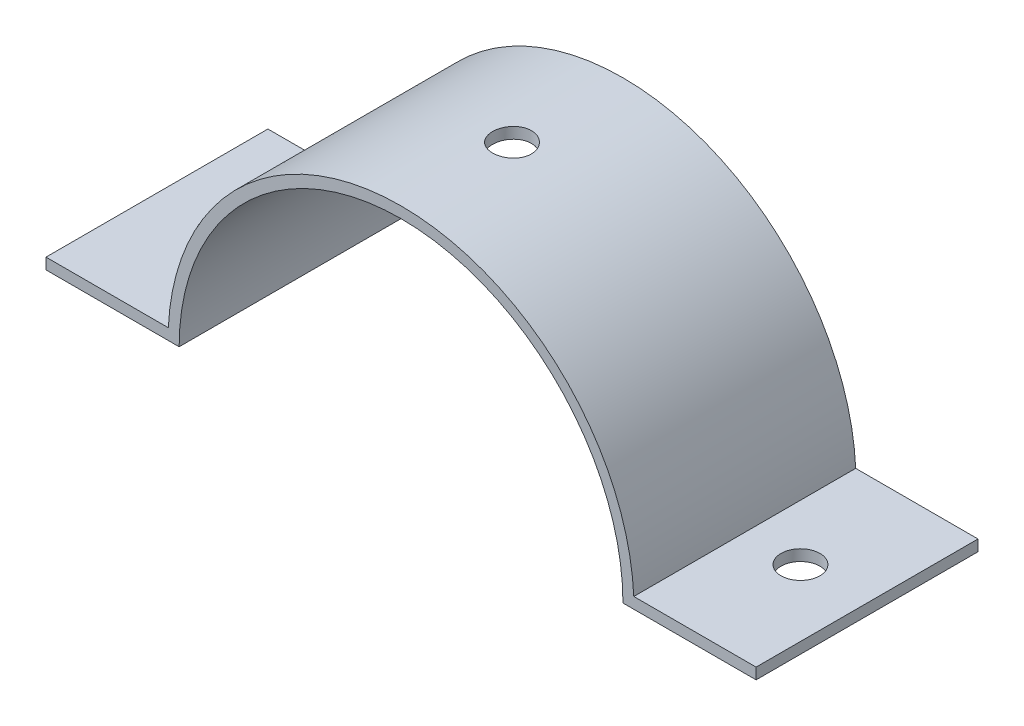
SolidWorks part; units mm, degrees
ref_plane "Front Plane" through (0, 0, 0) normal (0, 0, 1) x (1, 0, 0)
ref_plane "Top Plane" through (0, 0, 0) normal (0, 1, 0) x (1, 0, 0)
ref_plane "Right Plane" through (0, 0, 0) normal (1, 0, 0) x (0, 0, -1)
sketch "Sketch1" plane through (0, 0, 0) normal (0, 0, 1) x (1, 0, 0)
  line L0 (20, 0) -> (32, 0)
  line L1 (-20, 0) -> (-32, 0)
  line L2 (20.9762, 1) -> (32, 1)
  line L3 (-20.9762, 1) -> (-32, 1)
  line L4 (32, 1) -> (32, 0)
  line L5 (-32, 1) -> (-32, 0)
  arc A0 (20, 0) -> (-20, 0) centre (0, 0) ccw
  arc A1 (20.9762, 1) -> (-20.9762, 1) centre (0, 0) ccw
  dimension "D1" = 20
  dimension "D2" = 64
  dimension "D3" = 32
  dimension "D4" = 1
extrude "Extrude1" add sketch "Sketch1" along normal blind 20
sketch "Sketch2" plane through (0, 1, 0) normal (0, 1, 0) x (1, 0, 0)
  line L0 (32, -10) -> (-32, -10) construction
  line L3 (32, -20) -> (32, 0) construction
  line L4 (-32, -20) -> (-32, 0) construction
  line L5 (0, 0) -> (0, -20) construction
  line L6 (-20.9762, -20) -> (20.9762, -20) construction
  circle A0 centre (26, -10) radius 1.75
  circle A1 centre (-26, -10) radius 1.75
  dimension "D1" = 3.5
  dimension "D2" = 52
  dimension "D3" = 26
extrude "Extrude2" cut sketch "Sketch2" against normal blind 20
sketch "Sketch3" plane through (0, 0, 0) normal (0, 1, 0) x (1, 0, 0)
  line L0 (0, 0) -> (0, -20) construction
  line L1 (-20.9762, -20) -> (20.9762, -20) construction
  circle A0 centre (0, -10) radius 1.75
  dimension "D1" = 3.5
extrude "Extrude3" cut sketch "Sketch3" along normal through all
